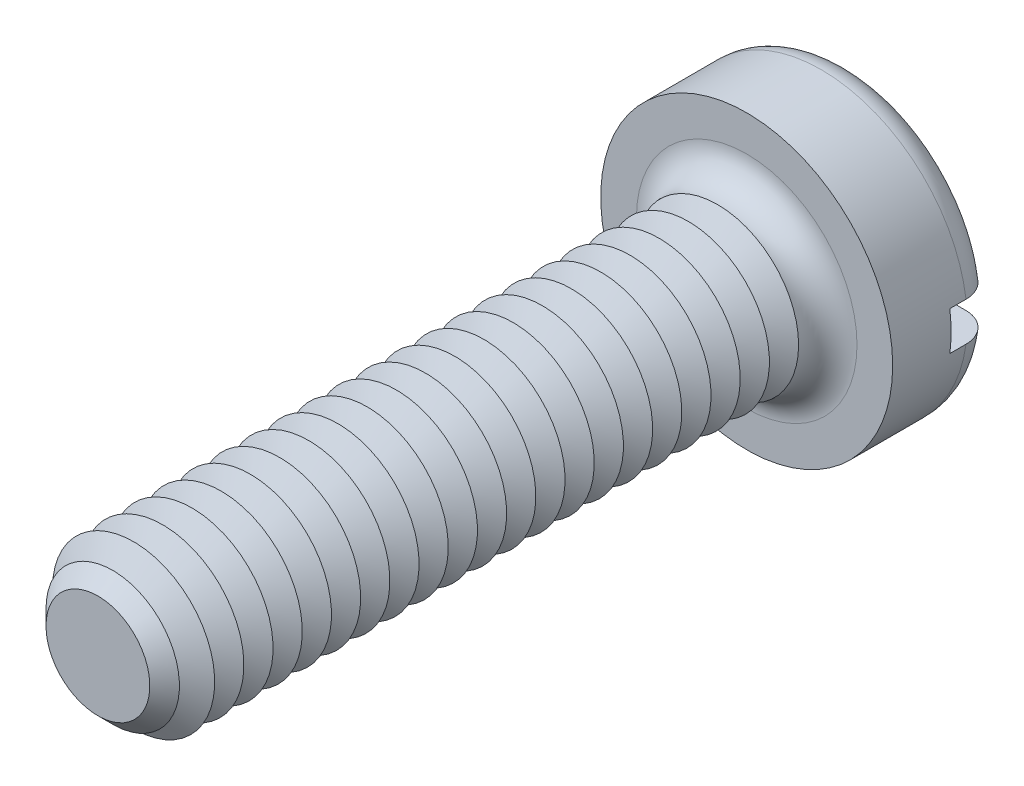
SolidWorks part; units mm, degrees
ref_plane "Front Plane" through (0, 0, 0) normal (0, 0, 1) x (1, 0, 0)
ref_plane "Top Plane" through (0, 0, 0) normal (0, 1, 0) x (1, 0, 0)
ref_plane "Right Plane" through (0, 0, 0) normal (1, 0, 0) x (0, 0, -1)
sketch "Sketch3" plane through (0, 0, 0) normal (0, 0, 1) x (1, 0, 0)
  circle A0 centre (0, 0) radius 2.25
  dimension "D1" = 4.5
extrude "Boss-Extrude2" add sketch "Sketch3" against normal blind 1.6
sketch "Sketch4" plane through (0, 0, 0) normal (0, 0, 1) x (1, 0, 0)
  circle A0 centre (0, 0) radius 1.25
  dimension "D1" = 2.5
extrude "Boss-Extrude3" add sketch "Sketch4" along normal blind 10
fillet "Fillet1" radius 0.45 2 edges at (2.25, 0, -1.6) (1.25, 0, 0)
chamfer "Chamfer1" distance 0.45 angle 45 1 edges at (1.25, 0, 10)
sketch "Sketch5" plane through (0, 0, 0) normal (1, 0, 0) x (0, 0, -1)
  line L0 (1.6944, 0) -> (-7.6738, 0) construction
sketch "Sketch6" plane through (0, 0, 0) normal (1, 0, 0) x (0, 0, -1)
  line L0 (-0.45, 1.25) -> (-0.675, 0.8603)
  line L1 (-0.675, 0.8603) -> (-0.9, 1.25)
  line L2 (-0.45, 1.25) -> (-9.55, 1.25) construction
  line L3 (-0.9, 1.25) -> (-0.45, 1.25)
  dimension "D1" = 0.45
revolve "Cut-Revolve1" cut sketch "Sketch6" angle 360 about L0
pattern_linear "LPattern1" count 21 spacing 0.45 along (0, 0, 1) of "Cut-Revolve1"
sketch "Sketch8" plane through (0, 0, -1.6) normal (0, 0, -1) x (-1, 0, 0)
  line L1 (2.25, -0.3) -> (-2.25, -0.3)
  line L2 (2.25, -0.3) -> (2.25, 0.3)
  line L3 (2.25, 0.3) -> (-2.25, 0.3)
  line L4 (-2.25, -0.3) -> (-2.25, 0.3)
  line L5 (2.25, -0.3) -> (-2.25, 0.3) construction
  line L6 (2.25, 0.3) -> (-2.25, -0.3) construction
  point P0 (0, 0)
  dimension "D1" = 4.5
  dimension "D2" = 0.6
extrude "Cut-Extrude1" cut sketch "Sketch8" against normal blind 0.7
